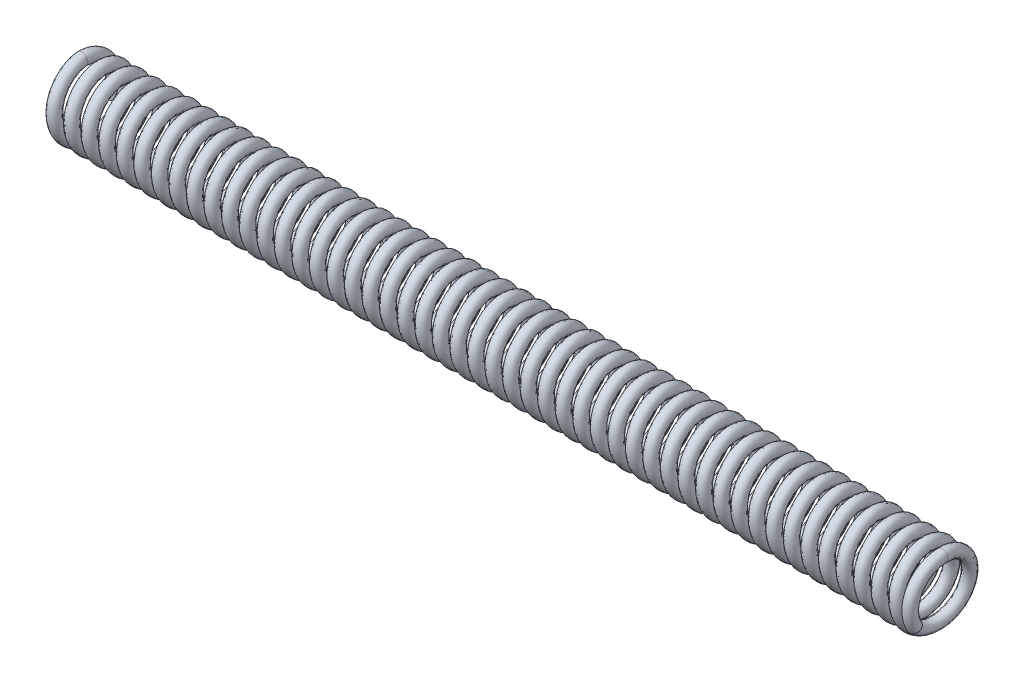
SolidWorks part; units mm, degrees
ref_plane "Спереди" through (0, 0, 0) normal (0, 0, 1) x (1, 0, 0)
ref_plane "Сверху" through (0, 0, 0) normal (0, 1, 0) x (1, 0, 0)
ref_plane "Справа" through (0, 0, 0) normal (1, 0, 0) x (0, 0, -1)
sketch "Эскиз1" plane through (0, 0, 0) normal (0, 0, 1) x (1, 0, 0)
  line L0 (-81.4949, -8.0423) -> (-81.4949, 20.193) construction
  circle A0 centre (-80.9691, 2.8321) radius 0.5258
  dimension "D1" = 1.0516
  dimension "D2" = 2.8321
sketch "Эскиз2" plane through (0, 0, 0) normal (0, 0, 1) x (1, 0, 0)
  line L0 (-80.9691, 0) -> (-4.5041, 0)
  circle A0 centre (-2.7781, 0) radius 1.2001 construction
  point P3 (-3.9783, 0)
  dimension "D1" = 0.5258
sweep "По траектории1" add profiles "Эскиз1" path "Эскиз2" parameters "D1"=17640
sketch "Эскиз3" plane through (0, 0, 0) normal (0, 0, -1) x (-1, 0, 0)
  line L0 (77.8457, 0) -> (84.6471, 0) construction
  circle A0 centre (80.9691, 2.8321) radius 0.5258 construction
  circle A1 centre (80.9691, 2.8321) radius 0.5258
revolve "Повернуть1" add sketch "Эскиз3" angle 120 about L0
sketch "Эскиз4" plane through (0, 0, 0) normal (0, 0, 1) x (1, 0, 0)
  line L0 (0, 0) -> (-9.736, 0) construction
  circle A0 centre (-4.5041, 2.8321) radius 0.5258 construction
  circle A1 centre (-4.5041, 2.8321) radius 0.5258
revolve "Повернуть2" add sketch "Эскиз4" angle 120 about L0
